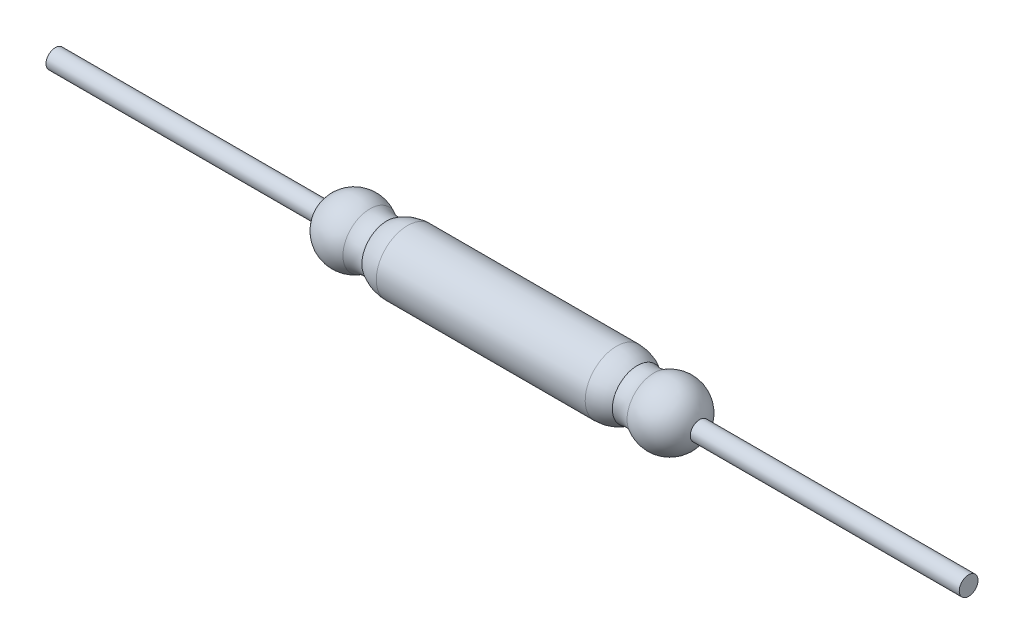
SolidWorks part; units mm, degrees
ref_plane "Face" through (0, 0, 0) normal (0, 0, 1) x (1, 0, 0)
ref_plane "Dessus" through (0, 0, 0) normal (0, 1, 0) x (1, 0, 0)
ref_plane "Droite" through (0, 0, 0) normal (1, 0, 0) x (0, 0, -1)
sketch "Esquisse1" plane through (0, 0, 0) normal (0, 0, 1) x (1, 0, 0)
  line L0 (0, 0) -> (50.3794, 0) construction
  line L1 (21.0025, 1) -> (27.6831, 1)
  line L2 (24.3428, 1) -> (24.3428, -2.8664) construction
  line L3 (18.3428, 0.3) -> (9.7441, 0.3)
  line L4 (9.7441, 0.3) -> (9.7441, 0)
  line L5 (38.9415, 0.3) -> (38.9415, 0)
  line L6 (30.3428, 0.3) -> (38.9415, 0.3)
  line L7 (38.9415, 0) -> (9.7441, 0)
  line L8 (32.9928, 2.6902) -> (46.9928, 2.6902) construction
  line L9 (39.9928, 2.6902) -> (39.9928, 0.8562) construction
  arc A0 (19.8012, 0.8634) -> (18.3428, 0.3) centre (19.2968, 0) ccw
  arc A1 (28.3469, 0.7968) -> (27.6831, 1) centre (27.6831, -0.1859) ccw
  arc A2 (19.8012, 0.8634) -> (20.3387, 0.7968) centre (20.1476, 1.4563) ccw
  arc A3 (20.3387, 0.7968) -> (21.0025, 1) centre (21.0025, -0.1859) cw
  arc A4 (28.8844, 0.8634) -> (28.3469, 0.7968) centre (28.538, 1.4563) cw
  arc A5 (28.8844, 0.8634) -> (30.3428, 0.3) centre (29.3889, 0) cw
  dimension "D1" = 0.6
  dimension "D4" = 1
  dimension "D5" = 1.4584
  dimension "D8" = 1.1859
  dimension "D2" = 12
  dimension "D3" = 1
  dimension "D6" = 1.9959
  dimension "D7" = 2.6597
revolve "Révolution1" add sketch "Esquisse1" angle 360 about L7
sketch "Esquisse2" plane through (9.7441, 0, 0) normal (-1, 0, 0) x (0, 0, 1)
  point P0 (0, 0)
